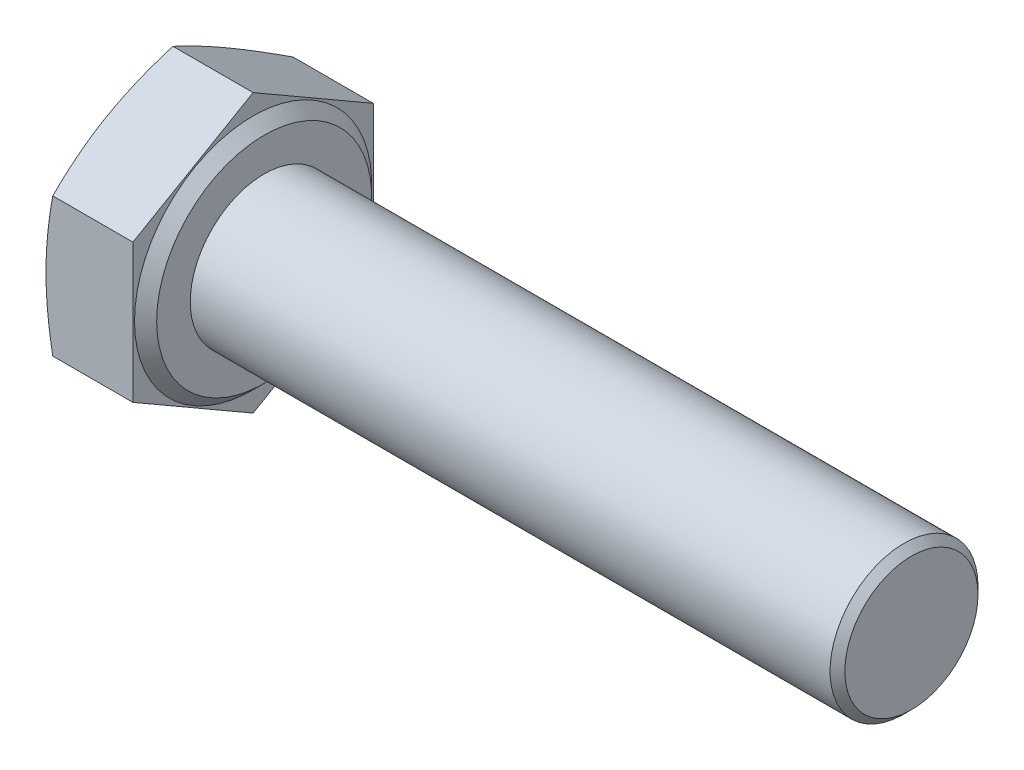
SolidWorks part; units mm, degrees
ref_plane "Front" through (0, 0, 0) normal (0, 0, 1) x (1, 0, 0)
ref_plane "Top" through (0, 0, 0) normal (0, 1, 0) x (1, 0, 0)
ref_plane "Right" through (0, 0, 0) normal (1, 0, 0) x (0, 0, -1)
sketch "Sketch2" plane through (0, 0, 0) normal (1, 0, 0) x (0, 0, -1)
  line L1 (0, -7.5056) -> (6.5, -3.7528)
  line L2 (6.5, -3.7528) -> (6.5, 3.7528)
  line L3 (6.5, 3.7528) -> (0, 7.5056)
  line L4 (0, 7.5056) -> (-6.5, 3.7528)
  line L5 (-6.5, 3.7528) -> (-6.5, -3.7528)
  line L6 (-6.5, -3.7528) -> (0, -7.5056)
  circle A0 centre (0, 0) radius 6.5 construction
  dimension "s" = 13
extrude "BaseHead" add sketch "Sketch2" along normal blind 5.3
sketch "Sketch3" plane through (0, 0, 0) normal (0, 0, 1) x (1, 0, 0)
  line L0 (5.3, 7.5056) -> (5.3, 5.815)
  line L2 (5.3, 5.815) -> (4.7, 6.415)
  line L3 (4.7, 6.415) -> (4.7, 7.5056)
  line L5 (4.7, 7.5056) -> (5.3, 7.5056)
  line L6 (-0.9571, 0) -> (7.6478, 0) construction
  line L7 (5.3, 7.5056) -> (0, 7.5056) construction
  dimension "D1" = 45
  dimension "c" = 0.6
  dimension "dw" = 11.63
revolve "BearingFace" cut sketch "Sketch3" angle 360 about L6
sketch "Sketch4" plane through (0, 0, 0) normal (0, 0, 1) x (1, 0, 0)
  line L0 (-0.4935, 0) -> (3.5626, 0) construction
  line L2 (0, 7.5056) -> (0.366, 7.5056)
  line L4 (0.366, 7.5056) -> (0, 6.5)
  line L6 (0, 6.5) -> (0, 7.5056)
  line L7 (4.7, 7.5056) -> (0, 7.5056) construction
  dimension "D1" = 20
  dimension "D2" = 13
revolve "HeadChamfer" cut sketch "Sketch4" angle 360 about L0
ref_plane "Plane1" through (22.3, 0, 0) normal (1, 0, 0) x (0, 0, -1)
sketch "Sketch5" plane through (5.3, 0, 0) normal (1, 0, 0) x (0, 0, -1)
  circle A0 centre (0, 0) radius 4
  dimension "d" = 8
extrude "BaseBody" add sketch "Sketch5" along normal blind 35
chamfer "Chamfer1" distance 0.4 angle 45 1 edges at (40.3, 0, -4)
fillet "HeadFillet" [suppressed] radius 0.4
sketch "Sketch6" plane through (0, 0, 0) normal (0, 0, 1) x (1, 0, 0)
  line L0 (39.4, 4.5) -> (39.9, 4.5)
  line L1 (39.9, 4.5) -> (39.9, 4)
  line L2 (39.9, 4) -> (39.65, 3.567)
  line L3 (39.65, 3.567) -> (39.4, 4)
  line L4 (39.4, 4) -> (39.4, 4.5)
  line L5 (39.9, -4) -> (39.9, 4) construction
  line L6 (39.9, 4) -> (5.3, 4) construction
  dimension "D1" = 0.5
revolve "Cut-Revolve10" [suppressed] cut sketch "Sketch6" angle 360
pattern_linear "LPattern10" [suppressed] count 30
equation "\"D2@Sketch4\" = \"s@Sketch2\""
equation "\"D1@Chamfer1\" = 0.05 * \"d@Sketch5\""
equation "\"D1@ThreadCosmetic1\" = \"l@BaseBody\" - \"lg@Plane1\""
equation "\"D1@Sketch6\" =  ( \"d@Sketch5\" - \"D2@ThreadCosmetic1\" )  / 2"
equation "\"pitch@LPattern10\" = 1.2 * \"D1@Sketch6\""
equation "\"D1@LPattern10\" = \"D1@ThreadCosmetic1\" / \"pitch@LPattern10\""
